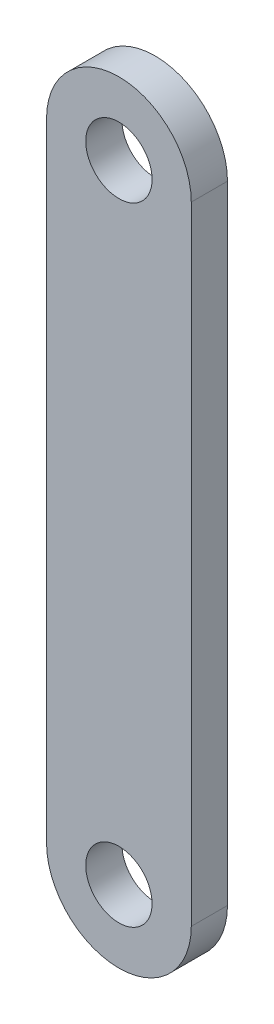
SolidWorks part; units mm, degrees
ref_plane "Front" through (0, 0, 0) normal (0, 0, 1) x (1, 0, 0)
ref_plane "Top" through (0, 0, 0) normal (0, 1, 0) x (1, 0, 0)
ref_plane "Right" through (0, 0, 0) normal (1, 0, 0) x (0, 0, -1)
sketch "Sketch1" plane through (0, 0, 0) normal (0, 0, 1) x (1, 0, 0)
  line L0 (-9.525, 41.275) -> (9.525, -41.275) construction
  line L2 (-9.525, 41.275) -> (-9.525, -41.275)
  line L4 (9.525, 41.275) -> (9.525, -41.275)
  circle A0 centre (0, 41.275) radius 4.3656
  arc A1 (9.525, 41.275) -> (-9.525, 41.275) centre (0, 41.275) ccw
  arc A2 (-9.525, -41.275) -> (9.525, -41.275) centre (0, -41.275) ccw
  circle A3 centre (0, -41.275) radius 4.3656
  dimension "D1" = 9.525
  dimension "D3" = 8.7312
  dimension "D2" = 82.55
extrude "Extrude1" add sketch "Sketch1" along normal blind 4.7625
equation "\"Buoyancy\"=\"SW-Volume\"*(\"SW-Density\"-.037062)"
